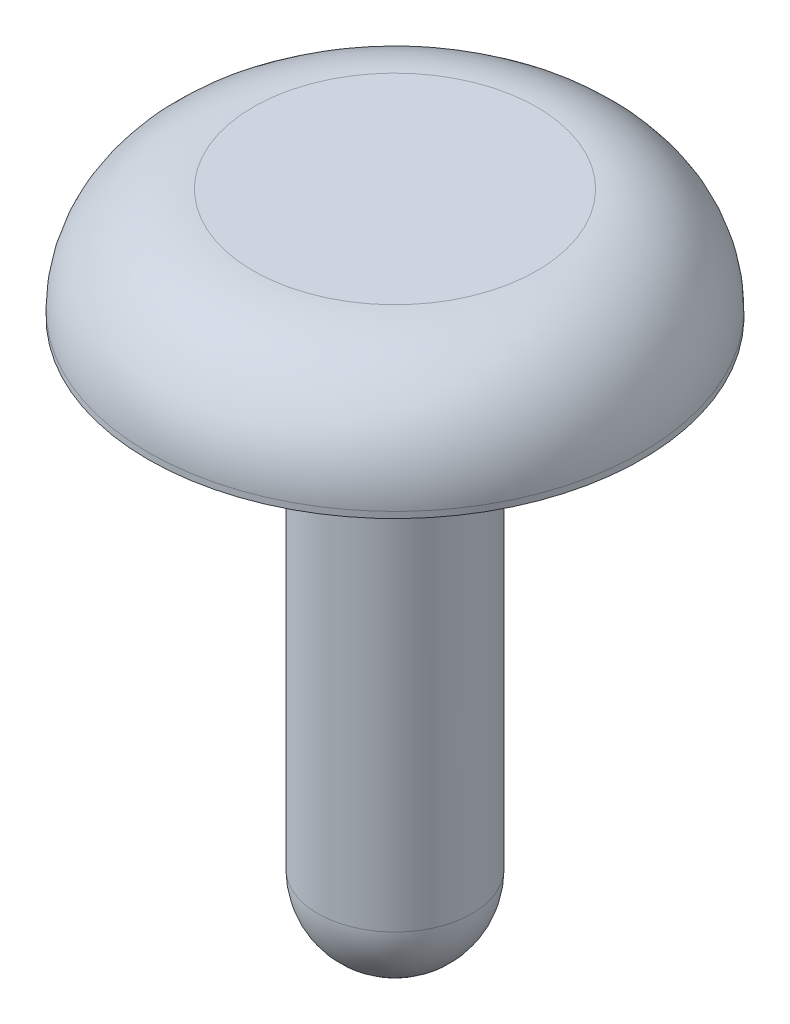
SolidWorks part; units mm, degrees
ref_plane "Plan de face" through (0, 0, 0) normal (0, 0, 1) x (1, 0, 0)
ref_plane "Plan de dessus" through (0, 0, 0) normal (0, 1, 0) x (1, 0, 0)
ref_plane "Plan de droite" through (0, 0, 0) normal (1, 0, 0) x (0, 0, -1)
sketch "Esquisse1" plane through (0, 0, 0) normal (0, 0, 1) x (1, 0, 0)
  line L0 (0, 0) -> (0, -13.042) construction
  line L1 (0, 0) -> (-2.3, 0)
  line L2 (-4, -1.7) -> (-4, -1.8)
  line L3 (-4, -1.8) -> (-3.3274, -1.8)
  line L4 (-1.25, -1.8) -> (-1.25, -9.55)
  line L5 (-3.3274, -1.8) -> (-2.75, -0.8)
  line L6 (-2.75, -0.8) -> (-1.25, -0.8)
  line L7 (-1.25, -0.8) -> (-1.25, -1.8)
  line L8 (0, 0) -> (0, -10.8)
  arc A0 (-1.25, -9.55) -> (0, -10.8) centre (0, -9.55) ccw
  arc A1 (-2.3, 0) -> (-4, -1.7) centre (-2.3, -1.7) ccw
  dimension "D5" = 1.25
  dimension "D6" = 1.5
  dimension "D1" = 1.25
  dimension "D9" = 1.7
  dimension "D2" = 9
  dimension "D3" = 1.8
  dimension "D4" = 4
  dimension "D7" = 120
  dimension "D8" = 1
revolve "Révolution1" add sketch "Esquisse1" angle 360 about L0
